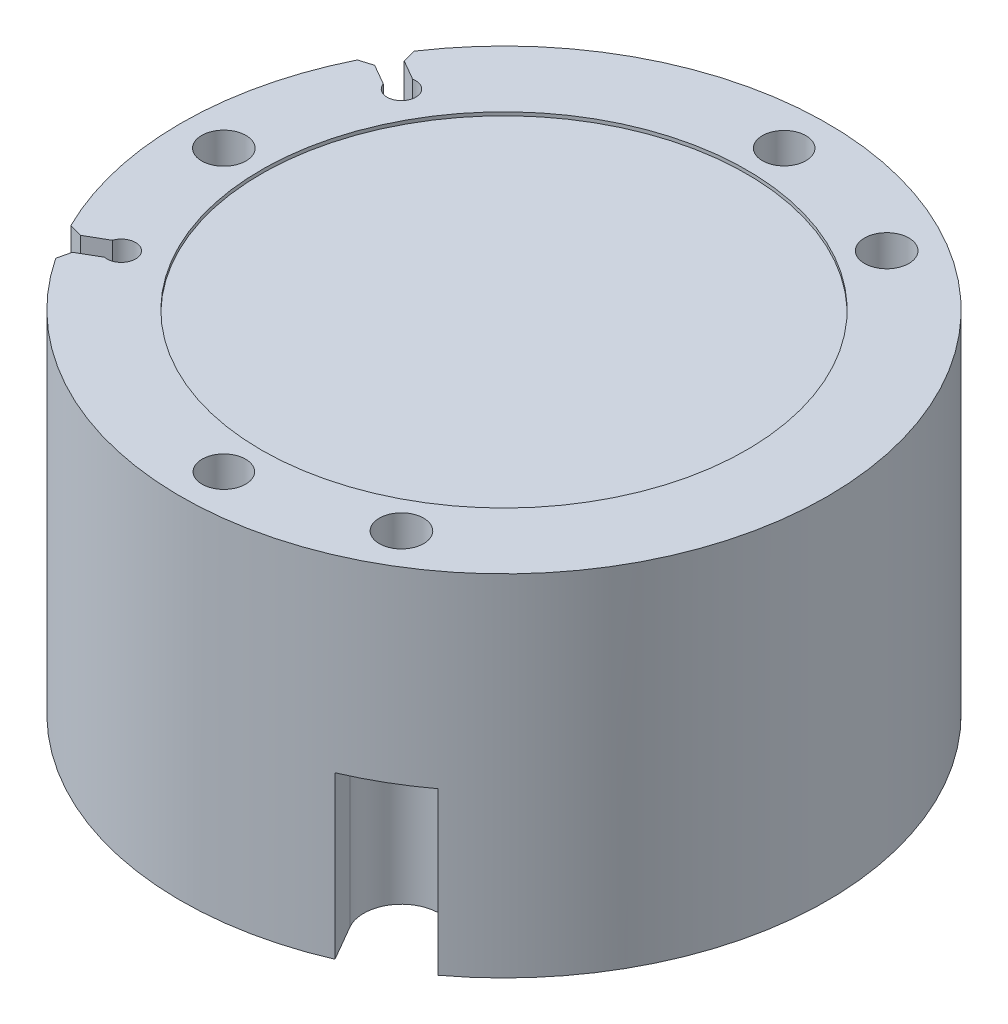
SolidWorks part; units mm, degrees
ref_plane "Front/Back" through (0, 0, 0) normal (0, 0, 1) x (1, 0, 0)
ref_plane "Top/Bottom" through (0, 0, 0) normal (0, 1, 0) x (1, 0, 0)
ref_plane "Right/Left" through (0, 0, 0) normal (1, 0, 0) x (0, 0, -1)
sketch "Sketch1" plane through (0, 0, 0) normal (0, 1, 0) x (1, 0, 0)
  circle A0 centre (0, 0) radius 47.625
  dimension "D1" = 95.25
extrude "Extrude1" add sketch "Sketch1" along normal mid plane 51.562
sketch "Sketch2" plane through (0, 25.781, 0) normal (0, 1, 0) x (-1, 0, 0)
  circle A0 centre (0, 0) radius 35.7505
  dimension "D1" = 71.501
extrude "Cut-Extrude1" cut sketch "Sketch2" against normal blind 0.508
sketch "Sketch5" plane through (0, 25.781, 0) normal (0, 1, 0) x (-1, 0, 0)
  line L0 (0, 0) -> (50.6501, 0) construction
  circle A0 centre (41.275, 0) radius 3.2639
  circle A1 centre (0, 0) radius 41.275 construction
  dimension "D1" = 82.55
  dimension "D2" = 6.5278
extrude "Cut-Extrude3" cut sketch "Sketch5" against normal through all
pattern_circular "CirPattern1" count 3 over 360 about axis through (0, 25.781, 0) along (0, -1, 0) of "Cut-Extrude3"
sketch "Sketch6" plane through (0, -25.781, 0) normal (0, -1, 0) x (1, 0, 0)
  line L0 (-41.275, 5.5562) -> (-47.2998, 5.5562)
  line L1 (-41.275, -5.5562) -> (-47.2998, -5.5563)
  arc A0 (-41.275, -5.5562) -> (-41.275, 5.5562) centre (-41.275, 0) ccw
  circle A2 centre (0, 0) radius 47.625
  arc A3 (-47.2998, 5.5562) -> (-47.2998, -5.5563) centre (0, 0) ccw
  dimension "D1" = 11.1125
  dimension "D2" = 0
extrude "Cut-Extrude4" cut sketch "Sketch6" against normal blind 23.7998
pattern_circular "CirPattern2" count 3 over 360 about axis through (0, 25.781, 0) along (0, -1, 0) of "Cut-Extrude4"
hole_wizard "5/16-18 (Mount Holes)" positions "Sketch8" profile "Sketch7" tap size "5/16-18" standard "Ansi Inch"
sketch "Sketch8" plane through (0, 25.781, 0) normal (0, 1, 0) x (-1, 0, 0)
  point P0 (41.275, 0)
sketch "Sketch7" plane through (-41.275, 25.781, 0) normal (1, 0, 0) x (0, 0, 1)
  line L0 (0, 0) -> (0, 51.562)
  line L1 (0, 51.562) -> (3.2639, 51.562)
  line L2 (3.2639, 51.562) -> (3.2639, 0)
  line L5 (3.2639, 0) -> (0, 0)
  line L11 (0, -6.35) -> (0, 107.95) construction
  dimension "Thru Tap Drill Dia." = 6.5278
  dimension "Thru Tap Drill Depth" = 51.562
pattern_circular "CirPattern3" count 3 over 360 about axis through (0, 25.781, 0) along (0, -1, 0) of "5/16-18 (Mount Holes)"
hole_wizard "(1/4 Dowel Hole - Slip Fit)" positions "Sketch10" profile "Sketch9" legacy
sketch "Sketch10" plane through (0, 25.781, 0) normal (0, 1, 0) x (-1, 0, 0)
  line L0 (0, 0) -> (0, 50.8244) construction
  line L1 (0, 0) -> (0, -51.1731) construction
  circle A0 centre (0, 0) radius 41.275
  point P0 (0, -41.275)
  point P1 (0, 41.275)
  dimension "D1" = 82.55
sketch "Sketch9" plane through (0, 25.781, -41.275) normal (1, 0, 0) x (0, 0, 1)
  line L0 (0, 0) -> (0, 12.0868)
  line L1 (0, 12.0868) -> (3.2067, 10.16)
  line L2 (3.2067, 10.16) -> (3.2067, 0)
  line L4 (3.2067, 0) -> (0, 0)
  line L6 (0, 12.0868) -> (-3.2067, 10.16) construction
  line L7 (0, -4.2442) -> (0, 117.3081) construction
  dimension "Diameter" = 6.4135
  dimension "Depth" = 10.16
  dimension "Drill Angle" = 118
sketch "Sketch11" plane through (0, 25.781, 0) normal (0, 1, 0) x (-1, 0, 0)
  line L0 (0, 0) -> (62.419, 0) construction
  line L1 (0, 0) -> (56.6991, -32.7352) construction
  line L2 (36.1528, 22.7059) -> (40.4278, 25.1741)
  line L3 (37.7403, 19.9563) -> (42.0153, 22.4245)
  line L4 (37.7403, -19.9563) -> (42.0153, -22.4245)
  line L5 (36.1528, -22.7059) -> (40.4278, -25.1741)
  arc A0 (37.7403, -19.9563) -> (36.1528, -22.7059) centre (35.7452, -20.6375) ccw
  circle A1 centre (0, 0) radius 41.275 construction
  arc A2 (40.4278, 25.1741) -> (42.0153, 22.4245) centre (0, 0) cw
  circle A3 centre (0, 0) radius 47.625
  arc A4 (40.4278, -25.1741) -> (42.0153, -22.4245) centre (0, 0) ccw
  arc A5 (37.7403, 19.9563) -> (36.1528, 22.7059) centre (35.7452, 20.6375) cw
  dimension "D1" = 4.2164
  dimension "D3" = 82.55
  dimension "D2" = 30
  dimension "D4" = 3.175
  dimension "D5" = 0
extrude "Cut-Extrude5" cut sketch "Sketch11" against normal through all
chamfer "Chamfer1" distance 1.524 angle 45 4 edges at (-42.0153, 0, -22.4245) (-40.4278, 0, -25.1741) (-42.0153, 0, 22.4245) (-40.4278, 0, 25.1741)
sketch "Sketch12" plane through (0, -25.781, 0) normal (0, -1, 0) x (1, 0, 0)
  circle A0 centre (0, 0) radius 34.925
  dimension "D1" = 69.85
extrude "Cut-Extrude6" cut sketch "Sketch12" against normal blind 21.082
sketch "Sketch13" plane through (0, -25.781, 0) normal (0, -1, 0) x (1, 0, 0)
  line L0 (0, 0) -> (0, 50.4757) construction
  line L1 (0, 0) -> (57.014, 0) construction
  line L3 (19.05, 12.7) -> (44.45, 12.7)
  line L4 (19.05, 12.7) -> (19.05, -12.7)
  line L5 (19.05, -12.7) -> (44.45, -12.7)
  line L6 (44.45, 12.7) -> (44.45, -12.7)
  dimension "D1" = 44.45
  dimension "D2" = 25.4
  dimension "D3" = 25.4
extrude "Cut-Extrude7" cut sketch "Sketch13" against normal up to surface (21.082 mm away)
fillet "Fillet1" radius 6.35 2 edges at (44.45, -15.24, -12.7) (44.45, -15.24, 12.7)
pattern_circular "CirPattern6" count 3 over 360 about axis through (0, 25.781, 0) along (0, -1, 0) of "Cut-Extrude7"
fillet "Fillet2" radius 6.35 4 edges at (-11.2265, -15.24, -44.8448) (-33.2235, -15.24, -32.1448) (-33.2235, -15.24, 32.1448) (-11.2265, -15.24, 44.8448)
